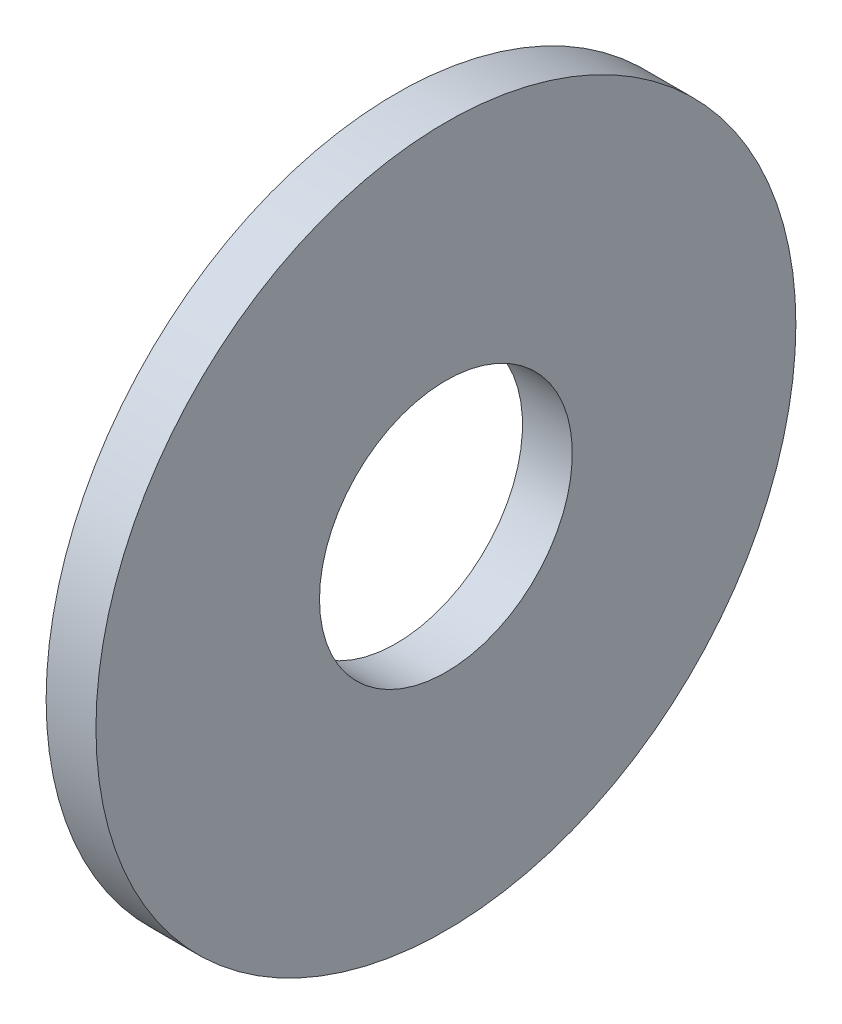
SolidWorks part; units mm, degrees
ref_plane "Plane1" through (0, 0, 0) normal (0, 0, 1) x (1, 0, 0)
ref_plane "Plane2" through (0, 0, 0) normal (0, 1, 0) x (1, 0, 0)
ref_plane "Plane3" through (0, 0, 0) normal (1, 0, 0) x (0, 0, -1)
sketch "Sketch1" plane through (0, 0, 0) normal (0, 0, 1) x (1, 0, 0)
  line L0 (-34.925, 0) -> (9.525, 0) construction
  line L1 (0, 2.5781) -> (0, 7.1374)
  line L2 (0, 7.1374) -> (-1.016, 7.1374)
  line L3 (-1.016, 7.1374) -> (-1.016, 2.5781)
  line L4 (-1.016, 2.5781) -> (0, 2.5781)
  dimension "Thickness" = 1.016
  dimension "Inside_dia" = 5.1562
  dimension "Outside_dia" = 14.2748
revolve "Base-Revolve" add sketch "Sketch1" angle 360 about L0
